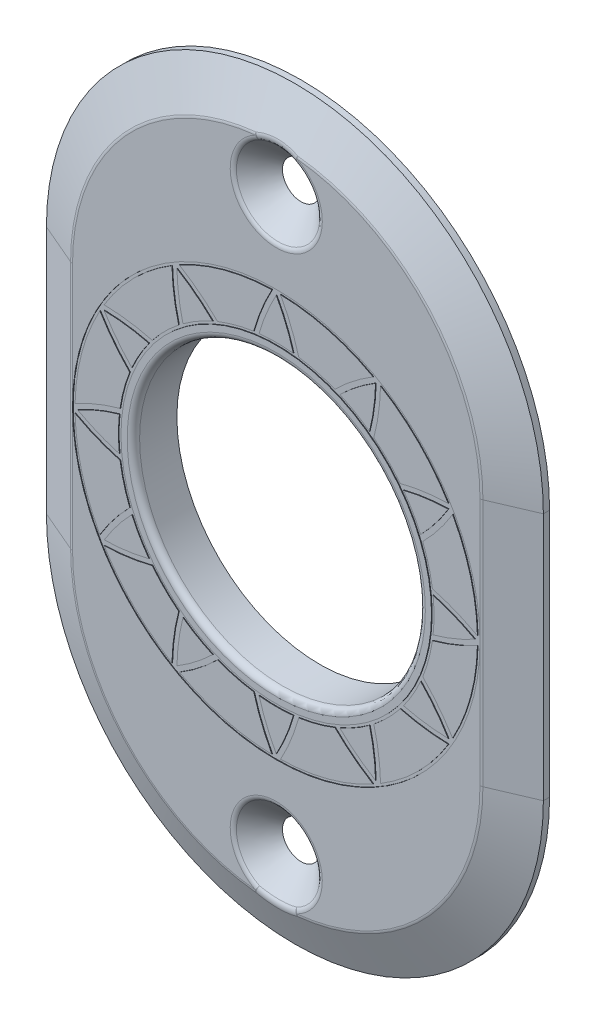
SolidWorks part; units mm, degrees
ref_plane "Plan de face" through (0, 0, 0) normal (0, 0, 1) x (1, 0, 0)
ref_plane "Plan de dessus" through (0, 0, 0) normal (0, 1, 0) x (1, 0, 0)
ref_plane "Plan de droite" through (0, 0, 0) normal (1, 0, 0) x (0, 0, -1)
sketch "Esquisse1" plane through (0, 0, 0) normal (0, 0, 1) x (1, 0, 0)
  line L0 (-20, 10) -> (20, -10) construction
  line L1 (-20, 10) -> (20, 10) construction
  line L2 (-20, 10) -> (-20, -10)
  line L3 (-20, -10) -> (20, -10) construction
  line L4 (20, 10) -> (20, -10)
  line L5 (0, 23) -> (0, -23) construction
  circle A0 centre (0, 0) radius 11.5
  arc A1 (20, 10) -> (-20, 10) centre (0, 10) ccw
  arc A2 (-20, -10) -> (20, -10) centre (0, -10) ccw
  circle A3 centre (0, 23) radius 1.5
  circle A4 centre (0, -23) radius 1.5
  dimension "D1" = 23
  dimension "D4" = 3
  dimension "D2" = 40
  dimension "D3" = 20
  dimension "D5" = 46
extrude "Boss.-Extru.1" add sketch "Esquisse1" along normal blind 2
chamfer "Chanfrein1" distance 1.5 distance2 3.5 4 edges at (0, -30, 2) (20, 0, 2) (-20, 0, 2) (0, 30, 2)
chamfer "Chanfrein2" distance 2 angle 45 2 edges at (1.5, -23, 2) (1.5, 23, 2)
fillet "Congé1" radius 0.5 7 edges at (16.5, 0, 2) (-11.6673, -21.6673, 2) (11.6673, -21.6673, 2) (-16.5, 0, 2) (11.5, 0, 2) (11.6673, 21.6673, 2) (-11.6673, 21.6673, 2)
shell "Coque1" thickness 0.5
fillet "Congé2" radius 0.5 2 edges at (0, -19.5, 2) (0, 19.5, 2)
sketch "Esquisse2" plane through (0, 0, 0) normal (0, 0, -1) x (-1, 0, 0)
  circle A0 centre (0, 0) radius 11.5 construction
  circle A1 centre (0, 0) radius 12
  circle A2 centre (0, 0) radius 12
  circle A3 centre (0, 0) radius 11.5
  dimension "D1" = 0
extrude "Boss.-Extru.2" add sketch "Esquisse2" along normal blind 1.5
sketch "Esquisse3" plane through (0, 0, 2) normal (0, 0, 1) x (1, 0, 0)
  line L0 (-16.3974, 10) -> (-16.3974, -10) construction
  line L1 (0, 0) -> (-16.3974, 0) construction
  line L2 (0, 0) -> (0, 16.3974) construction
  line L3 (0, 0) -> (14.2005, 8.1987) construction
  line L4 (-14.2005, 8.1987) -> (0, 0) construction
  line L5 (0, 0) -> (-8.1987, 14.2005) construction
  line L6 (0, 0) -> (-4.7645, 11.5564) construction
  line L7 (-1.652, 12.3904) -> (0, 12.5) construction
  line L8 (-6.25, 10.8253) -> (-4.7645, 11.5564) construction
  circle A0 centre (0, 0) radius 12 construction
  arc A1 (-4.7645, 11.5564) -> (-6.25, 10.8253) centre (0, 0) ccw construction
  arc A2 (-1.652, 12.3904) -> (-4.7645, 11.5564) centre (0, 0) ccw
  arc A3 (0, 12.5) -> (-1.652, 12.3904) centre (0, 0) ccw
  arc A4 (-4.7645, 11.5564) -> (-8.1987, 14.2005) centre (-16.3974, 0) ccw construction
  arc A5 (0, 12.7) -> (-1.3804, 12.6248) centre (0, 0) ccw
  arc A6 (1.3804, 12.6248) -> (0, 12.7) centre (0, 0) ccw
  arc A7 (1.3804, 12.6248) -> (0, 15.9897) centre (-14.2005, 8.1987) ccw
  arc A8 (0, 15.9897) -> (-1.3804, 12.6248) centre (14.2005, 8.1987) ccw
  arc A9 (-1.8108, 12.5702) -> (-4.7169, 11.7915) centre (0, 0) ccw
  arc A10 (0, 12.7) -> (-1.6785, 12.5886) centre (0, 0) ccw construction
  arc A11 (-4.7169, 11.7915) -> (-7.7987, 14.1963) centre (-16.3974, 0) ccw
  arc A12 (1.3804, 12.6248) -> (-0.1732, 16.2974) centre (-14.2005, 8.1987) ccw construction
  arc A13 (-0.3443, 16.1937) -> (-1.8108, 12.5702) centre (14.2005, 8.1987) ccw
  arc A14 (7.9948, 13.8475) -> (5.1169, 11.6235) centre (16.3974, 0) ccw
  arc A15 (-0.3443, 16.1937) -> (-7.7987, 14.1963) centre (0, 0) ccw
  arc A16 (0, 16.3974) -> (-1.652, 12.3904) centre (14.2005, 8.1987) ccw construction
  arc A17 (-1.6785, 12.5886) -> (-4.7169, 11.7915) centre (0, 0) ccw construction
  arc A18 (0, 16.1974) -> (-7.7987, 14.1963) centre (0, 0) ccw construction
  arc A19 (7.5078, 10.2432) -> (7.9948, 13.8475) centre (-8.1987, 14.2005) ccw
  arc A20 (7.5078, 10.2432) -> (6.35, 10.9985) centre (0, 0) ccw
  arc A21 (0, 16.3974) -> (-8.1987, 14.2005) centre (0, 0) ccw
  arc A22 (1.652, 12.3904) -> (0, 12.5) centre (0, 0) ccw
  arc A23 (1.652, 12.3904) -> (0, 16.3974) centre (-14.2005, 8.1987) ccw construction
  arc A24 (6.35, 10.9985) -> (5.1169, 11.6235) centre (0, 0) ccw
  arc A25 (6.25, 10.8253) -> (4.7645, 11.5564) centre (0, 0) ccw
  arc A26 (7.6259, 9.9043) -> (6.25, 10.8253) centre (0, 0) ccw
  arc A27 (4.7645, 11.5564) -> (1.652, 12.3904) centre (0, 0) ccw
  arc A28 (4.7169, 11.7915) -> (1.8108, 12.5702) centre (0, 0) ccw
  arc A29 (1.8108, 12.5702) -> (0.3443, 16.1937) centre (-14.2005, 8.1987) ccw
  arc A30 (7.7987, 14.1963) -> (0.3443, 16.1937) centre (0, 0) ccw
  arc A31 (7.7987, 14.1963) -> (4.7169, 11.7915) centre (16.3974, 0) ccw
  arc A32 (8.1987, 14.2005) -> (0, 16.3974) centre (0, 0) ccw
  arc A33 (13.8475, 7.9948) -> (10.2432, 7.5078) centre (14.2005, -8.1987) ccw
  arc A34 (11.6235, 5.1169) -> (13.8475, 7.9948) centre (0, 16.3974) ccw
  arc A35 (11.6235, 5.1169) -> (10.9985, 6.35) centre (0, 0) ccw
  arc A36 (10.9985, 6.35) -> (10.2432, 7.5078) centre (0, 0) ccw
  arc A37 (10.8253, 6.25) -> (9.9043, 7.6259) centre (0, 0) ccw
  arc A38 (11.5564, 4.7645) -> (10.8253, 6.25) centre (0, 0) ccw
  arc A39 (9.9043, 7.6259) -> (7.6259, 9.9043) centre (0, 0) ccw
  arc A40 (9.9808, 7.8533) -> (7.8533, 9.9808) centre (0, 0) ccw
  arc A41 (7.8533, 9.9808) -> (8.395, 13.852) centre (-8.1987, 14.2005) ccw
  arc A42 (13.852, 8.395) -> (8.395, 13.852) centre (0, 0) ccw
  arc A43 (13.852, 8.395) -> (9.9808, 7.8533) centre (14.2005, -8.1987) ccw
  arc A44 (14.2005, 8.1987) -> (8.1987, 14.2005) centre (0, 0) ccw
  arc A45 (15.9897, 0) -> (12.6248, 1.3804) centre (8.1987, -14.2005) ccw
  arc A46 (12.6248, -1.3804) -> (15.9897, 0) centre (8.1987, 14.2005) ccw
  arc A47 (12.6248, -1.3804) -> (12.7, 0) centre (0, 0) ccw
  arc A48 (12.7, 0) -> (12.6248, 1.3804) centre (0, 0) ccw
  arc A49 (12.5, 0) -> (12.3904, 1.652) centre (0, 0) ccw
  arc A50 (12.3904, -1.652) -> (12.5, 0) centre (0, 0) ccw
  arc A51 (12.3904, 1.652) -> (11.5564, 4.7645) centre (0, 0) ccw
  arc A52 (12.5702, 1.8108) -> (11.7915, 4.7169) centre (0, 0) ccw
  arc A53 (11.7915, 4.7169) -> (14.1963, 7.7987) centre (0, 16.3974) ccw
  arc A54 (16.1937, 0.3443) -> (14.1963, 7.7987) centre (0, 0) ccw
  arc A55 (16.1937, 0.3443) -> (12.5702, 1.8108) centre (8.1987, -14.2005) ccw
  arc A56 (16.3974, 0) -> (14.2005, 8.1987) centre (0, 0) ccw
  arc A57 (13.8475, -7.9948) -> (11.6235, -5.1169) centre (0, -16.3974) ccw
  arc A58 (10.2432, -7.5078) -> (13.8475, -7.9948) centre (14.2005, 8.1987) ccw
  arc A59 (10.2432, -7.5078) -> (10.9985, -6.35) centre (0, 0) ccw
  arc A60 (10.9985, -6.35) -> (11.6235, -5.1169) centre (0, 0) ccw
  arc A61 (10.8253, -6.25) -> (11.5564, -4.7645) centre (0, 0) ccw
  arc A62 (9.9043, -7.6259) -> (10.8253, -6.25) centre (0, 0) ccw
  arc A63 (11.5564, -4.7645) -> (12.3904, -1.652) centre (0, 0) ccw
  arc A64 (11.7915, -4.7169) -> (12.5702, -1.8108) centre (0, 0) ccw
  arc A65 (12.5702, -1.8108) -> (16.1937, -0.3443) centre (8.1987, 14.2005) ccw
  arc A66 (14.1963, -7.7987) -> (16.1937, -0.3443) centre (0, 0) ccw
  arc A67 (14.1963, -7.7987) -> (11.7915, -4.7169) centre (0, -16.3974) ccw
  arc A68 (14.2005, -8.1987) -> (16.3974, 0) centre (0, 0) ccw
  arc A69 (7.9948, -13.8475) -> (7.5078, -10.2432) centre (-8.1987, -14.2005) ccw
  arc A70 (5.1169, -11.6235) -> (7.9948, -13.8475) centre (16.3974, 0) ccw
  arc A71 (5.1169, -11.6235) -> (6.35, -10.9985) centre (0, 0) ccw
  arc A72 (6.35, -10.9985) -> (7.5078, -10.2432) centre (0, 0) ccw
  arc A73 (6.25, -10.8253) -> (7.6259, -9.9043) centre (0, 0) ccw
  arc A74 (4.7645, -11.5564) -> (6.25, -10.8253) centre (0, 0) ccw
  arc A75 (7.6259, -9.9043) -> (9.9043, -7.6259) centre (0, 0) ccw
  arc A76 (7.8533, -9.9808) -> (9.9808, -7.8533) centre (0, 0) ccw
  arc A77 (9.9808, -7.8533) -> (13.852, -8.395) centre (14.2005, 8.1987) ccw
  arc A78 (8.395, -13.852) -> (13.852, -8.395) centre (0, 0) ccw
  arc A79 (8.395, -13.852) -> (7.8533, -9.9808) centre (-8.1987, -14.2005) ccw
  arc A80 (8.1987, -14.2005) -> (14.2005, -8.1987) centre (0, 0) ccw
  arc A81 (0, -15.9897) -> (1.3804, -12.6248) centre (-14.2005, -8.1987) ccw
  arc A82 (-1.3804, -12.6248) -> (0, -15.9897) centre (14.2005, -8.1987) ccw
  arc A83 (-1.3804, -12.6248) -> (0, -12.7) centre (0, 0) ccw
  arc A84 (0, -12.7) -> (1.3804, -12.6248) centre (0, 0) ccw
  arc A85 (0, -12.5) -> (1.652, -12.3904) centre (0, 0) ccw
  arc A86 (-1.652, -12.3904) -> (0, -12.5) centre (0, 0) ccw
  arc A87 (1.652, -12.3904) -> (4.7645, -11.5564) centre (0, 0) ccw
  arc A88 (1.8108, -12.5702) -> (4.7169, -11.7915) centre (0, 0) ccw
  arc A89 (4.7169, -11.7915) -> (7.7987, -14.1963) centre (16.3974, 0) ccw
  arc A90 (0.3443, -16.1937) -> (7.7987, -14.1963) centre (0, 0) ccw
  arc A91 (0.3443, -16.1937) -> (1.8108, -12.5702) centre (-14.2005, -8.1987) ccw
  arc A92 (0, -16.3974) -> (8.1987, -14.2005) centre (0, 0) ccw
  arc A93 (-7.9948, -13.8475) -> (-5.1169, -11.6235) centre (-16.3974, 0) ccw
  arc A94 (-7.5078, -10.2432) -> (-7.9948, -13.8475) centre (8.1987, -14.2005) ccw
  arc A95 (-7.5078, -10.2432) -> (-6.35, -10.9985) centre (0, 0) ccw
  arc A96 (-6.35, -10.9985) -> (-5.1169, -11.6235) centre (0, 0) ccw
  arc A97 (-6.25, -10.8253) -> (-4.7645, -11.5564) centre (0, 0) ccw
  arc A98 (-7.6259, -9.9043) -> (-6.25, -10.8253) centre (0, 0) ccw
  arc A99 (-4.7645, -11.5564) -> (-1.652, -12.3904) centre (0, 0) ccw
  arc A100 (-4.7169, -11.7915) -> (-1.8108, -12.5702) centre (0, 0) ccw
  arc A101 (-1.8108, -12.5702) -> (-0.3443, -16.1937) centre (14.2005, -8.1987) ccw
  arc A102 (-7.7987, -14.1963) -> (-0.3443, -16.1937) centre (0, 0) ccw
  arc A103 (-7.7987, -14.1963) -> (-4.7169, -11.7915) centre (-16.3974, 0) ccw
  arc A104 (-8.1987, -14.2005) -> (0, -16.3974) centre (0, 0) ccw
  arc A105 (-13.8475, -7.9948) -> (-10.2432, -7.5078) centre (-14.2005, 8.1987) ccw
  arc A106 (-11.6235, -5.1169) -> (-13.8475, -7.9948) centre (0, -16.3974) ccw
  arc A107 (-11.6235, -5.1169) -> (-10.9985, -6.35) centre (0, 0) ccw
  arc A108 (-10.9985, -6.35) -> (-10.2432, -7.5078) centre (0, 0) ccw
  arc A109 (-10.8253, -6.25) -> (-9.9043, -7.6259) centre (0, 0) ccw
  arc A110 (-11.5564, -4.7645) -> (-10.8253, -6.25) centre (0, 0) ccw
  arc A111 (-9.9043, -7.6259) -> (-7.6259, -9.9043) centre (0, 0) ccw
  arc A112 (-9.9808, -7.8533) -> (-7.8533, -9.9808) centre (0, 0) ccw
  arc A113 (-7.8533, -9.9808) -> (-8.395, -13.852) centre (8.1987, -14.2005) ccw
  arc A114 (-13.852, -8.395) -> (-8.395, -13.852) centre (0, 0) ccw
  arc A115 (-13.852, -8.395) -> (-9.9808, -7.8533) centre (-14.2005, 8.1987) ccw
  arc A116 (-14.2005, -8.1987) -> (-8.1987, -14.2005) centre (0, 0) ccw
  arc A117 (-15.9897, 0) -> (-12.6248, -1.3804) centre (-8.1987, 14.2005) ccw
  arc A118 (-12.6248, 1.3804) -> (-15.9897, 0) centre (-8.1987, -14.2005) ccw
  arc A119 (-12.6248, 1.3804) -> (-12.7, 0) centre (0, 0) ccw
  arc A120 (-12.7, 0) -> (-12.6248, -1.3804) centre (0, 0) ccw
  arc A121 (-12.5, 0) -> (-12.3904, -1.652) centre (0, 0) ccw
  arc A122 (-12.3904, 1.652) -> (-12.5, 0) centre (0, 0) ccw
  arc A123 (-12.3904, -1.652) -> (-11.5564, -4.7645) centre (0, 0) ccw
  arc A124 (-12.5702, -1.8108) -> (-11.7915, -4.7169) centre (0, 0) ccw
  arc A125 (-11.7915, -4.7169) -> (-14.1963, -7.7987) centre (0, -16.3974) ccw
  arc A126 (-16.1937, -0.3443) -> (-14.1963, -7.7987) centre (0, 0) ccw
  arc A127 (-16.1937, -0.3443) -> (-12.5702, -1.8108) centre (-8.1987, 14.2005) ccw
  arc A128 (-16.3974, 0) -> (-14.2005, -8.1987) centre (0, 0) ccw
  arc A129 (-13.8475, 7.9948) -> (-11.6235, 5.1169) centre (0, 16.3974) ccw
  arc A130 (-10.2432, 7.5078) -> (-13.8475, 7.9948) centre (-14.2005, -8.1987) ccw
  arc A131 (-10.2432, 7.5078) -> (-10.9985, 6.35) centre (0, 0) ccw
  arc A132 (-10.9985, 6.35) -> (-11.6235, 5.1169) centre (0, 0) ccw
  arc A133 (-10.8253, 6.25) -> (-11.5564, 4.7645) centre (0, 0) ccw
  arc A134 (-9.9043, 7.6259) -> (-10.8253, 6.25) centre (0, 0) ccw
  arc A135 (-11.5564, 4.7645) -> (-12.3904, 1.652) centre (0, 0) ccw
  arc A136 (-11.7915, 4.7169) -> (-12.5702, 1.8108) centre (0, 0) ccw
  arc A137 (-12.5702, 1.8108) -> (-16.1937, 0.3443) centre (-8.1987, -14.2005) ccw
  arc A138 (-14.1963, 7.7987) -> (-16.1937, 0.3443) centre (0, 0) ccw
  arc A139 (-14.1963, 7.7987) -> (-11.7915, 4.7169) centre (0, 16.3974) ccw
  arc A140 (-14.2005, 8.1987) -> (-16.3974, 0) centre (0, 0) ccw
  arc A141 (-7.9948, 13.8475) -> (-7.5078, 10.2432) centre (8.1987, 14.2005) ccw
  arc A142 (-5.1169, 11.6235) -> (-7.9948, 13.8475) centre (-16.3974, 0) ccw
  arc A143 (-5.1169, 11.6235) -> (-6.35, 10.9985) centre (0, 0) ccw
  arc A144 (-6.35, 10.9985) -> (-7.5078, 10.2432) centre (0, 0) ccw
  arc A145 (-6.25, 10.8253) -> (-7.6259, 9.9043) centre (0, 0) ccw
  arc A146 (-4.7645, 11.5564) -> (-6.25, 10.8253) centre (0, 0) ccw
  arc A147 (-7.6259, 9.9043) -> (-9.9043, 7.6259) centre (0, 0) ccw
  arc A148 (-7.8533, 9.9808) -> (-9.9808, 7.8533) centre (0, 0) ccw
  arc A149 (-9.9808, 7.8533) -> (-13.852, 8.395) centre (-14.2005, -8.1987) ccw
  arc A150 (-8.395, 13.852) -> (-13.852, 8.395) centre (0, 0) ccw
  arc A151 (-8.395, 13.852) -> (-7.8533, 9.9808) centre (8.1987, 14.2005) ccw
  arc A152 (-8.1987, 14.2005) -> (-14.2005, 8.1987) centre (0, 0) ccw
  point P11 (0.2912, 16.5698)
  point P12 (-1.4587, 12.3392)
  point P33 (-0.1732, 16.4974)
  point P37 (-1.8454, 12.4415)
  dimension "D1" = 0.5
  dimension "D2" = 60
  dimension "D7" = 0.2
  dimension "D3" = 30
  dimension "D4" = 0.2
  dimension "D8" = 12
  dimension "D6" = 0.2
  dimension "D5" = 2
extrude "Enlèv. mat.-Extru.1" cut sketch "Esquisse3" against normal blind 0.05 contours A21 A152 A140 A128 A116 A104 A92 A80 A68 A56 A44 A32 A150 A151 A148 A149 A147 A145 A146 A2 A3 A22 A27 A25 A26 A39 A37 A38 A51 A49 A50 A63 A61 A62 A75 A73 A74 A87 A85 A86 A99 A97 A98 A111 A109 A110 A123 A121 A122
